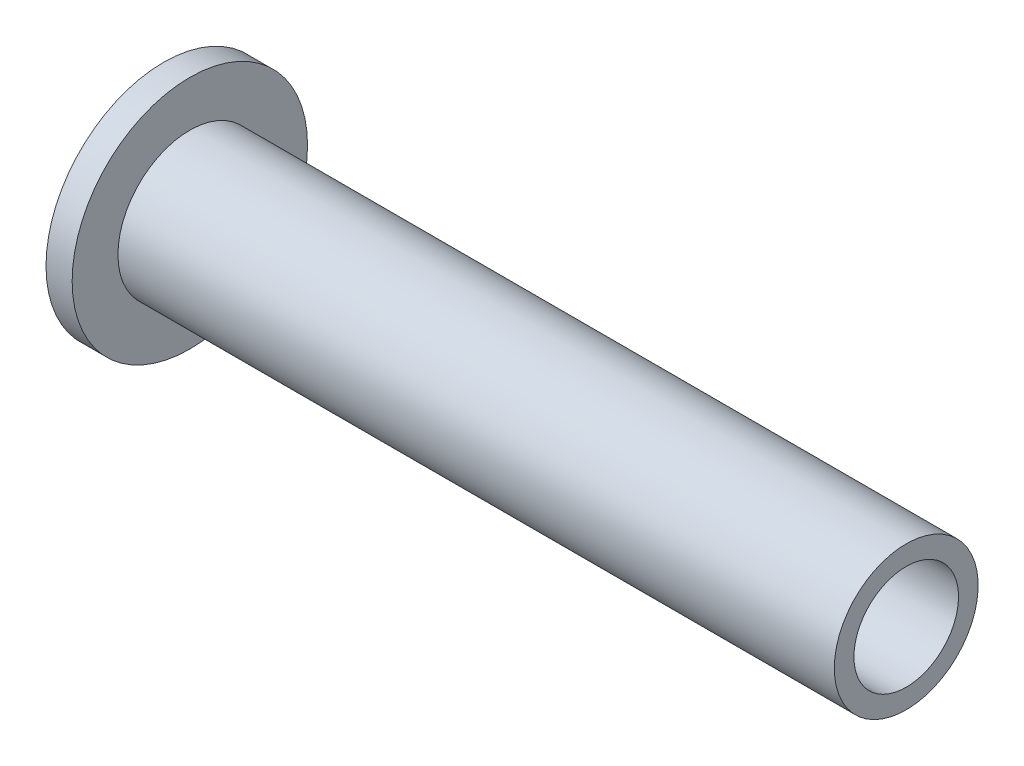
SolidWorks part; units mm, degrees
ref_plane "Plan1" through (0, 0, 0) normal (0, 0, 1) x (1, 0, 0)
ref_plane "Plan2" through (0, 0, 0) normal (0, 1, 0) x (1, 0, 0)
ref_plane "Plan3" through (0, 0, 0) normal (1, 0, 0) x (0, 0, -1)
sketch "Esquisse1" plane through (0, 0, 0) normal (0, 0, 1) x (1, 0, 0)
  line L0 (0, 0) -> (120, 0) construction
  line L1 (0, 4) -> (56.7853, 4)
  line L2 (56.7853, 4) -> (56.7853, 5.5)
  line L3 (56.7853, 5.5) -> (2, 5.5)
  line L4 (2, 5.5) -> (2, 9)
  line L5 (2, 9) -> (0, 9)
  line L6 (0, 9) -> (0, 4)
  dimension "D1" = 56.7853
  dimension "D2" = 9
  dimension "D3" = 8
  dimension "D4" = 2
  dimension "D5" = 5.5
revolve "Base-Révolution" add sketch "Esquisse1" angle 360 about L0
